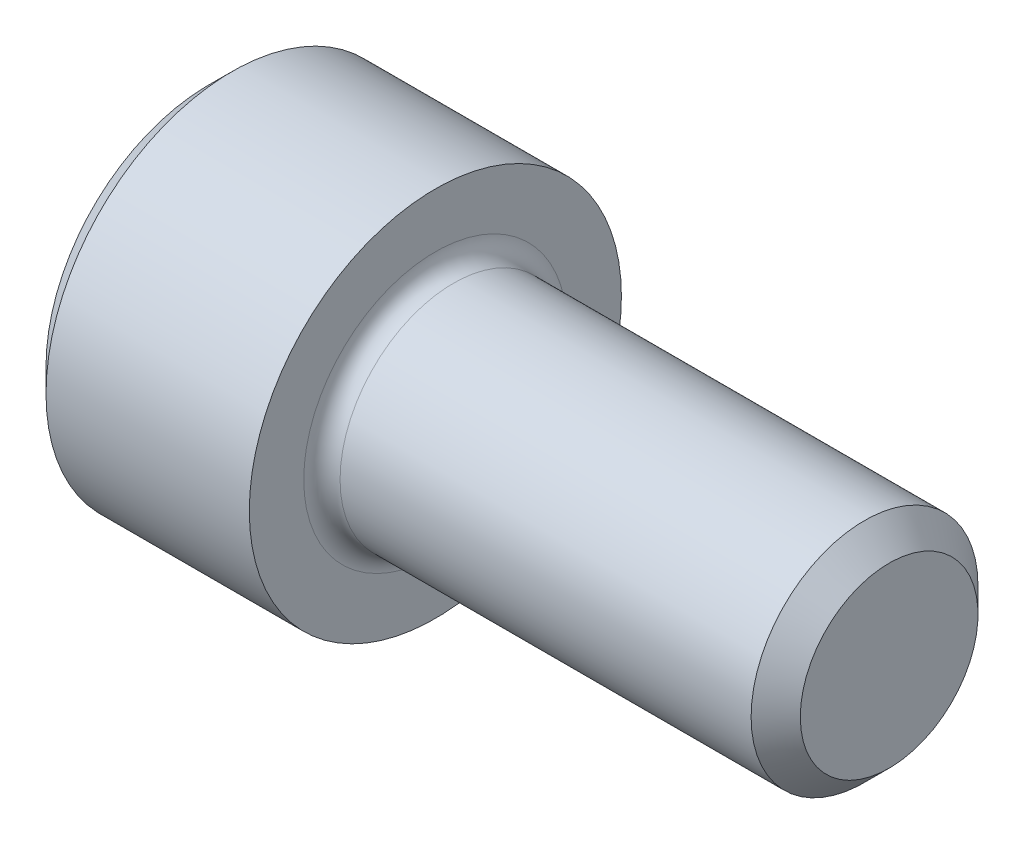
SolidWorks part; units mm, degrees
ref_plane "Plane1" through (0, 0, 0) normal (0, 0, 1) x (1, 0, 0)
ref_plane "Plane2" through (0, 0, 0) normal (0, 1, 0) x (1, 0, 0)
ref_plane "Plane3" through (0, 0, 0) normal (1, 0, 0) x (0, 0, -1)
revolve "Base-Revolve" add sketch "BodySke"
sketch "BodySke" plane through (0, 0, 0) normal (0, 0, 1) x (1, 0, 0)
  line L0 (0, 0) -> (0, 2.2733)
  line L1 (0.3302, 2.6035) -> (3.175, 2.6035)
  line L2 (3.175, 2.6035) -> (3.175, 1.5875)
  line L3 (3.175, 1.5875) -> (9.1808, 1.5875)
  line L4 (9.525, 1.2433) -> (9.525, 0)
  line L5 (9.525, 0) -> (0, 0)
  line L6 (-31.75, 0) -> (127, 0) construction
  line L7 (0, 2.2733) -> (0.3302, 2.6035)
  line L8 (9.525, 1.2433) -> (9.1808, 1.5875)
  line L9 (0, -2.2733) -> (0.3302, -2.6035) construction
  line L10 (9.525, -1.2433) -> (9.1808, -1.5875) construction
  line L11 (3.7516, 9.525) -> (3.7516, 3.175) construction
  line L12 (3.175, 9.525) -> (3.175, 3.175) construction
  line L13 (-28.575, 9.525) -> (-28.575, 3.175) construction
  dimension "Diameter" = 3.175
  dimension "Head_ht" = 3.175
  dimension "Length" = 6.35
  dimension "Body_ch_ang" = 45
  dimension "Head_dia" = 5.207
  dimension "Head_ch_ang" = 45
  dimension "Head_side_ht" = 2.8448
  dimension "Minor_dia" = 2.4867
  dimension "Advance" = 0.5766
  dimension "Thread_nom" = 6.35
  dimension "Thread_length" = 38.1
fillet "Fillet1" radius 0.254 1 edges at (3.175, 0, 1.5875)
sketch "Sketch2" plane through (0, 0, 0) normal (0, 0, 1) x (1, 0, 0)
  line L0 (0, 1.1938) -> (1.4478, 1.1938)
  line L1 (1.4478, 1.1938) -> (2.137, 0)
  line L2 (-31.75, 0) -> (127, 0) construction
  line L3 (2.137, 0) -> (0, 0)
  line L4 (0, 0) -> (0, 1.1938)
  line L5 (0, 2.2733) -> (0, -2.2733) construction
  line L6 (0, 0) -> (47.625, 0) construction
  line L7 (3.175, -2.6035) -> (3.175, 2.6035) construction
  dimension "D1" = 1.1938
  dimension "D2" = 60
  dimension "Wall_thickness" = 1.7272
revolve "Hex-PreBroach" cut sketch "Sketch2" angle 360 about L6
sketch "Sketch3" plane through (0, 0, 0) normal (-1, 0, 0) x (0, 0.5, 0.866)
  line L0 (0.6892, 1.1938) -> (-0.6892, 1.1938)
  line L1 (-0.6892, 1.1938) -> (-1.3785, 0)
  line L2 (0.6892, 1.1938) -> (1.3785, 0)
  line L3 (0.6892, -1.1938) -> (1.3785, 0)
  line L4 (0.6892, -1.1938) -> (-0.6892, -1.1938)
  line L5 (-0.6892, -1.1938) -> (-1.3785, 0)
  dimension "D1" = 1.1938
  dimension "D2" = 1.1938
  dimension "Hex_size" = 2.3876
extrude "Hex" cut sketch "Sketch3" against normal blind 1.4478
sketch "Sketch4" plane through (0, 0, 0) normal (-1, 0, 0) x (0, 0, 1)
  line L0 (0, 0) -> (1.4605, 0)
  line L1 (0, 0) -> (6.1484, 3.5498) construction
  line L2 (0, 0) -> (0.7302, 1.2648)
  line L3 (1.2009, 0.3267) -> (1.3933, 0.4378)
  line L4 (0.8834, 0.8767) -> (1.0758, 0.9877)
  arc A0 (1.2009, 0.3267) -> (0.8834, 0.8767) centre (0, 0) ccw
  arc A1 (1.4605, 0) -> (1.3933, 0.4378) centre (0, 0) ccw
  arc A2 (0.7302, 1.2648) -> (1.0758, 0.9877) centre (0, 0) cw
  dimension "D1" = 30
  dimension "Spline_n_dim" = 2.4892
  dimension "Spline_m_dim" = 2.921
  dimension "D2" = 60
  dimension "D3" = 0.3175
  dimension "Spline_p_dim" = 0.635
extrude "Spline" cut sketch "Sketch4" against normal blind 1.4478
pattern_circular "CirPattern1" count 6 every 60
sketch "Sketch5" plane through (0, 0, 0) normal (0, 0, 1) x (1, 0, 0)
  line L0 (-31.75, 0) -> (127, 0) construction
  line L2 (0, 2.2733) -> (0, -2.2733) construction
  circle A0 centre (1.143, 0) radius 0.4445
  dimension "Drilled_hole_dia" = 0.889
  dimension "Drilled_hole_loc" = 1.143
extrude "Hole" cut sketch "Sketch5" against normal through all and the other way through all
pattern_circular "Drilled-4" count 2 every 60
pattern_circular "Drilled-6" count 3 every 60
sketch "ThdSchSke" plane through (0, 0, 0) normal (0, 0, 1) x (1, 0, 0)
  line L0 (3.7516, -1.2433) -> (3.5106, -1.5875)
  line L1 (3.7516, -1.2433) -> (3.9926, -1.5875)
  line L2 (3.9926, -1.5875) -> (3.9926, -1.9844)
  line L3 (-3.175, 0) -> (5.1513, 0) construction
  line L5 (3.9926, -1.9844) -> (3.5106, -1.9844)
  line L6 (3.5106, -1.9844) -> (3.5106, -1.5875)
  line L7 (0, 2.2733) -> (0, -2.2733) construction
  dimension "Thread_minor" = 2.4867
  dimension "Diameter" = 3.175
  dimension "Start" = 3.7516
  dimension "SideAngle" = 55
  dimension "VeeAngle" = 70
  dimension "Overcut" = 3.9688
revolve "ThreadSchematic" cut sketch "ThdSchSke" angle 360 about L3
pattern_linear "ThdSchPat"
equation "\"D2@Sketch3\" = \"Hex_size@Sketch3\" / 2"
equation "\"D1@Sketch3\" = \"Hex_size@Sketch3\" / 2"
equation "\"D1@Sketch2\" = \"Hex_size@Sketch3\" / 2"
equation "\"D3@Sketch4\" = \"Spline_p_dim@Sketch4\" / 2"
equation "\"Thread_minor@ThreadCosmetic\"  =  \"Minor_dia@BodySke\""
equation "\"D2@CirPattern1\" = 360 / \"Num_teeth@CirPattern1\""
equation "\"Wall_thickness@Sketch2\" = \"Head_ht@BodySke\" - \"Key_eng@Hex\""
equation "\"Thread_length@ThreadCosmetic\" = ((sgn( (\"Length@BodySke\" - \"Advance@BodySke\" ) - \"Thread_nom@BodySke\" )-1)*( (\"Length@BodySke\" - \"Advance@BodySke\" ) - \"Thread_nom@BodySke\" ))/-2+ \"Thread_nom@BodySke\""
equation "\"Thread_minor@ThdSchSke\" = \"Minor_dia@BodySke\""
equation "\"Diameter@ThdSchSke\" = \"Diameter@BodySke\""
equation "\"Overcut@ThdSchSke\" = \"Diameter@BodySke\" * 1.25"
equation "\"Start@ThdSchSke\" = \"Head_ht@BodySke\" + \"Length@BodySke\" - \"Thread_length@ThreadCosmetic\"  '---Non-countersunk---"
equation "\"Num_threads@ThdSchPat\" = int( \"Thread_length@ThreadCosmetic\" / \"Advance@BodySke\" + 0.999 )  + 1"
equation "\"Advance@ThdSchPat\" = \"Thread_length@ThreadCosmetic\" /  (\"Num_threads@ThdSchPat\" - 1) 'relax it"
equation "\"Num_threads@ThdSchPat\" = \"Num_threads@ThdSchPat\" - sgn( \"Num_threads@ThdSchPat\" - 1) '---chamfered tips only---"
